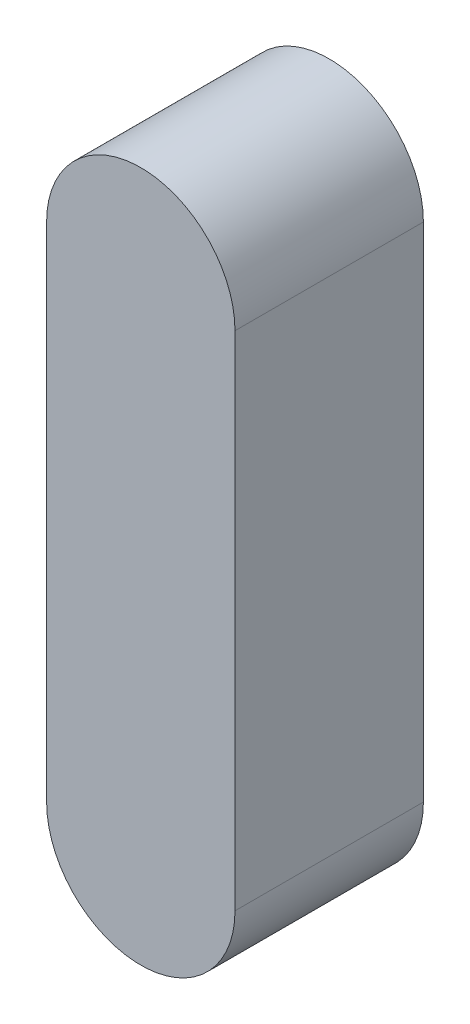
SolidWorks part; units mm, degrees
ref_plane "Front" through (0, 0, 0) normal (0, 0, 1) x (1, 0, 0)
ref_plane "Top" through (0, 0, 0) normal (0, 1, 0) x (1, 0, 0)
ref_plane "Right" through (0, 0, 0) normal (1, 0, 0) x (0, 0, -1)
sketch "Sketch1" plane through (0, 0, 0) normal (0, 0, 1) x (1, 0, 0)
  line L0 (1.5, 8) -> (1.5, 0)
  line L1 (-1.5, 8) -> (-1.5, 0)
  arc A0 (-1.5, 0) -> (1.5, 0) centre (0, 0) ccw
  arc A1 (1.5, 8) -> (-1.5, 8) centre (0, 8) ccw
  dimension "D1" = 3
  dimension "D2" = 8
extrude "Base-Extrude" add sketch "Sketch1" along normal blind 3
